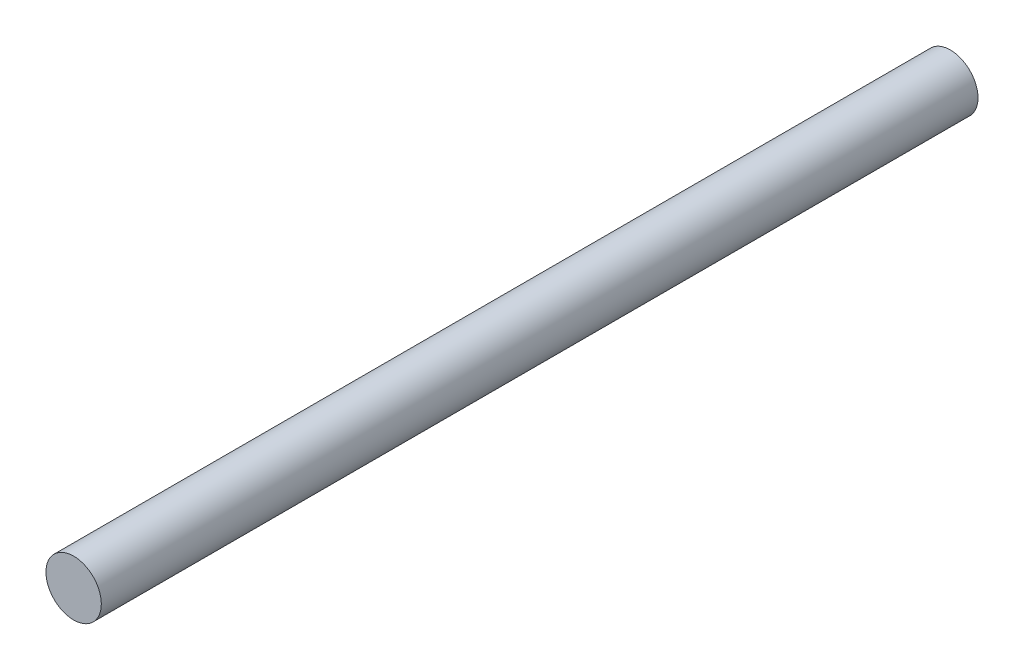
SolidWorks part; units mm, degrees
ref_plane "Front Plane" through (0, 0, 0) normal (0, 0, 1) x (1, 0, 0)
ref_plane "Top Plane" through (0, 0, 0) normal (0, 1, 0) x (1, 0, 0)
ref_plane "Right Plane" through (0, 0, 0) normal (1, 0, 0) x (0, 0, -1)
sketch "Sketch1" plane through (0, 0, 0) normal (0, 0, 1) x (1, 0, 0)
  circle A0 centre (0, 0) radius 30
  dimension "D1" = 60
extrude "Boss-Extrude1" add sketch "Sketch1" against normal blind 950
